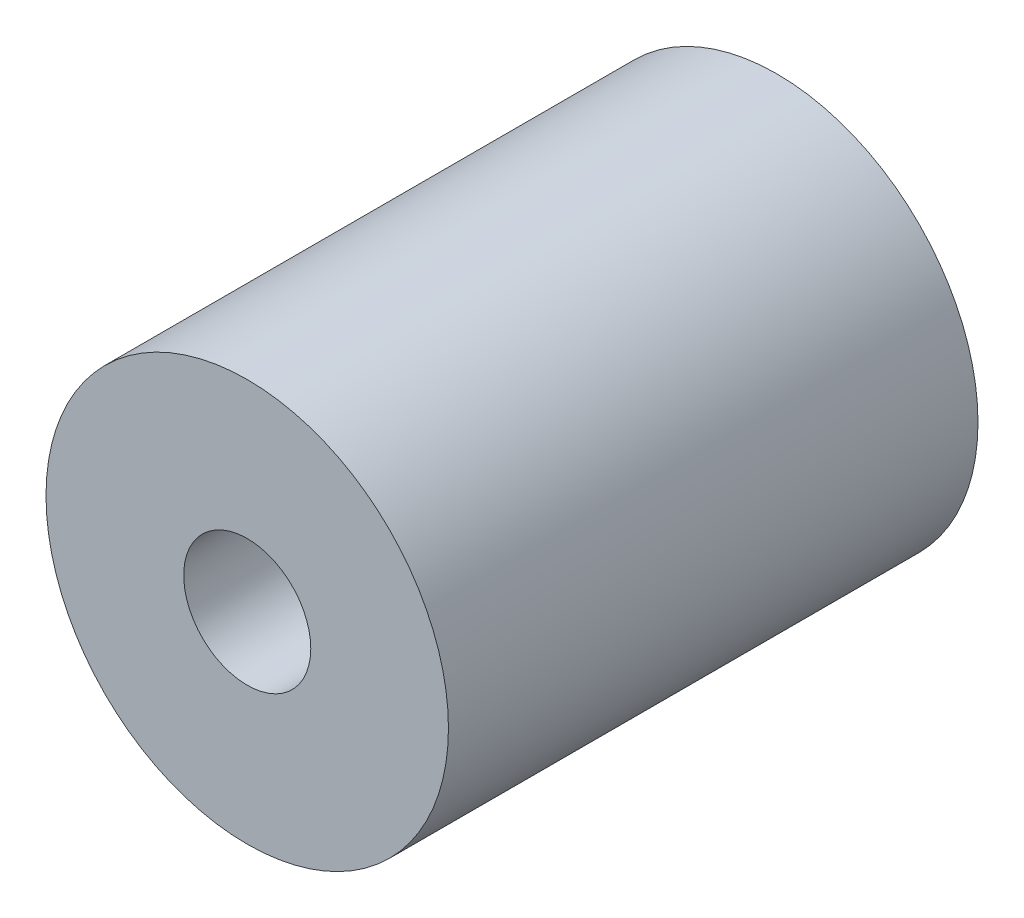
SolidWorks part; units mm, degrees
ref_plane "Plan de face" through (0, 0, 0) normal (0, 0, 1) x (1, 0, 0)
ref_plane "Plan de dessus" through (0, 0, 0) normal (0, 1, 0) x (1, 0, 0)
ref_plane "Plan de droite" through (0, 0, 0) normal (1, 0, 0) x (0, 0, -1)
sketch "Esquisse1" plane through (0, 0, 0) normal (0, 0, 1) x (1, 0, 0)
  circle A0 centre (0, 0) radius 9.5
  circle A1 centre (0, 0) radius 3
  dimension "D1" = 6
  dimension "D2" = 19
extrude "Boss.-Extru.1" add sketch "Esquisse1" along normal blind 25
